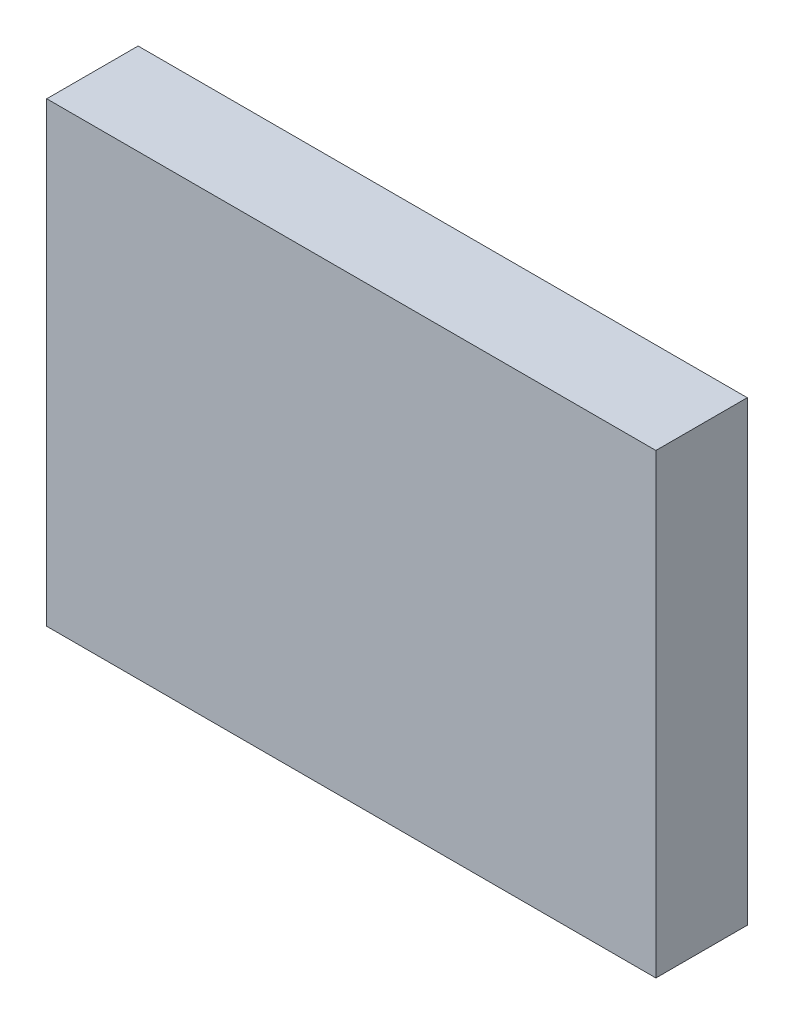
SolidWorks part; units mm, degrees
ref_plane "前视基准面" through (0, 0, 0) normal (0, 0, 1) x (1, 0, 0)
ref_plane "上视基准面" through (0, 0, 0) normal (0, 1, 0) x (1, 0, 0)
ref_plane "右视基准面" through (0, 0, 0) normal (1, 0, 0) x (0, 0, -1)
sketch "草图1" plane through (0, 0, 0) normal (0, 0, 1) x (1, 0, 0)
  line L1 (0, 0) -> (40, 0)
  line L2 (0, 0) -> (0, 30)
  line L3 (0, 30) -> (40, 30)
  line L4 (40, 0) -> (40, 30)
  dimension "D1" = 30
  dimension "D2" = 40
extrude "拉伸1" add sketch "草图1" along normal blind 6
